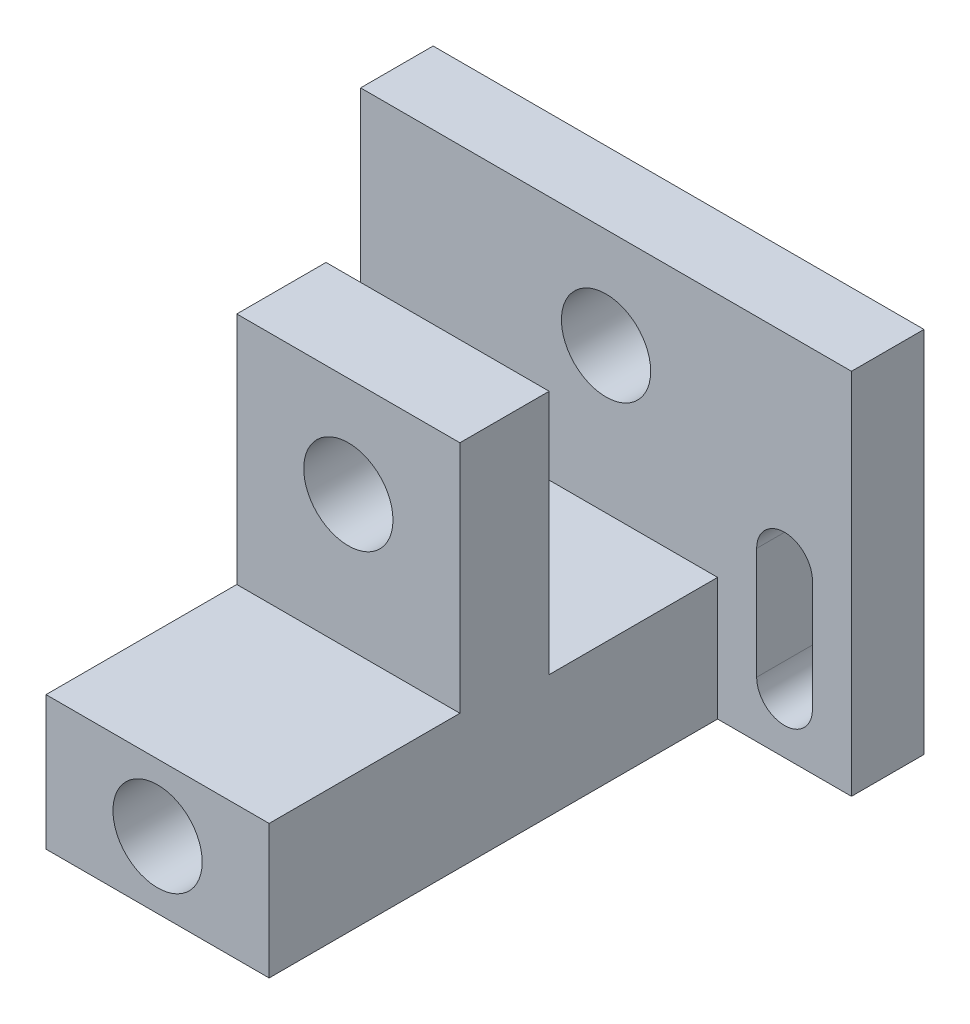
SolidWorks part; units mm, degrees
ref_plane "Ebene vorne" through (0, 0, 0) normal (0, 0, 1) x (1, 0, 0)
ref_plane "Ebene oben" through (0, 0, 0) normal (0, 1, 0) x (1, 0, 0)
ref_plane "Ebene rechts" through (0, 0, 0) normal (1, 0, 0) x (0, 0, -1)
sketch "Skizze1" plane through (0, 0, 0) normal (1, 0, 0) x (0, 0, -1)
  line L0 (-23.35, 0) -> (23.35, 0)
  line L1 (23.35, 0) -> (23.35, 33)
  line L2 (23.35, 33) -> (16.85, 33)
  line L3 (16.85, 33) -> (16.85, 11)
  line L4 (16.85, 11) -> (1.75, 11)
  line L5 (1.75, 11) -> (1.75, 33)
  line L6 (1.75, 33) -> (-6.25, 33)
  line L7 (-6.25, 33) -> (-6.25, 12)
  line L8 (-6.25, 12) -> (-23.35, 12)
  line L9 (-23.35, 12) -> (-23.35, 0)
  dimension "D1" = 6.5
  dimension "D2" = 8
  dimension "D3" = 15.1
  dimension "D4" = 17.1
  dimension "D5" = 12
  dimension "D6" = 11
  dimension "D7" = 33
extrude "Linear austragen1" add sketch "Skizze1" along normal blind 20
sketch "Skizze2" plane through (0, 33, 0) normal (0, 1, 0) x (1, 0, 0)
  line L0 (10, -6.25) -> (10, 1.75) construction
  line L1 (20, 23.35) -> (32, 23.35)
  line L2 (20, 23.35) -> (20, 16.85)
  line L3 (20, 16.85) -> (32, 16.85)
  line L4 (32, 23.35) -> (32, 16.85)
  line L5 (0, 23.35) -> (-12, 23.35)
  line L6 (0, 23.35) -> (0, 16.85)
  line L7 (0, 16.85) -> (-12, 16.85)
  line L8 (-12, 23.35) -> (-12, 16.85)
  line L9 (20, -6.25) -> (0, -6.25) construction
  line L10 (20, 1.75) -> (0, 1.75) construction
  line L11 (20, 16.85) -> (0, 16.85) construction
  dimension "D1" = 44
extrude "Linear austragen2" add sketch "Skizze2" against normal up to surface (33 mm away)
hole_wizard "Ø8.0 (8) Durchmesser Bohrung1" positions "Skizze4" profile "Skizze5" hole size "Ø8.0" standard "Ansi Metrisch"
sketch "Skizze4" plane through (0, 0, 6.25) normal (0, 0, 1) x (1, 0, 0)
  line L0 (10, 12) -> (10, 33) construction
  line L1 (20, 12) -> (0, 12) construction
  line L2 (20, 33) -> (0, 33) construction
  point P0 (10, 24)
  dimension "D1" = 9
sketch "Skizze5" plane through (10, 24, 6.25) normal (1, 0, 0) x (0, -1, 0)
  line L0 (0, 0) -> (0, 29.6)
  line L1 (0, 29.6) -> (4, 29.6)
  line L2 (4, 29.6) -> (4, 0)
  line L5 (4, 0) -> (0, 0)
  line L11 (0, -6.35) -> (0, 107.95) construction
  dimension "Bohrerdurchmesser" = 8
  dimension "Bohrungstiefe" = 29.6
sketch "Skizze6" plane through (0, 0, -16.85) normal (0, 0, 1) x (1, 0, 0)
  line L0 (23.5, 5) -> (23.5, 15)
  line L1 (28.5, 15) -> (28.5, 5)
  line L2 (-8.5, 5) -> (-8.5, 15)
  line L3 (-3.5, 15) -> (-3.5, 5)
  line L4 (10, 33) -> (10, 0) construction
  line L5 (20, 33) -> (0, 33) construction
  line L6 (20, 0) -> (0, 0) construction
  line L7 (32, 33) -> (-12, 33) construction
  arc A0 (23.5, 15) -> (28.5, 15) centre (26, 15) cw
  arc A1 (28.5, 5) -> (23.5, 5) centre (26, 5) cw
  arc A2 (-8.5, 15) -> (-3.5, 15) centre (-6, 15) cw
  arc A3 (-3.5, 5) -> (-8.5, 5) centre (-6, 5) cw
  dimension "D4" = 32
  dimension "D1" = 5
  dimension "D2" = 18
  dimension "D3" = 28
extrude "Schnitt-Linear austragen1" cut sketch "Skizze6" against normal up to next
hole_wizard "M8x1.0 Gewindebohrung1" positions "Skizze8" profile "Skizze9" tap size "M8x1.0" standard "Ansi Metrisch"
sketch "Skizze8" plane through (0, 0, 23.35) normal (0, 0, 1) x (1, 0, 0)
  line L0 (20, 0) -> (0, 0) construction
  line L2 (20, 0) -> (20, 11) construction
  point P0 (10, 6)
  dimension "D1" = 6
  dimension "D2" = 10
sketch "Skizze9" plane through (10, 6, 23.35) normal (1, 0, 0) x (0, -1, 0)
  line L0 (0, 0) -> (0, 30.103)
  line L1 (0, 30.103) -> (3.5, 28)
  line L2 (3.5, 28) -> (3.5, 26)
  line L3 (3.5, 26) -> (4, 26)
  line L4 (4, 26) -> (4, 0)
  line L5 (4, 0) -> (0, 0)
  line L10 (0, 30.103) -> (-3.5, 28) construction
  line L11 (0, -6.35) -> (0, 107.95) construction
  dimension "Bohrerdurchmesser" = 7
  dimension "Bohrungstiefe" = 28
  dimension "Nenndurchmesser" = 8
  dimension "Gewindelänge" = 26
  dimension "Spitzenwinkel" = 118
